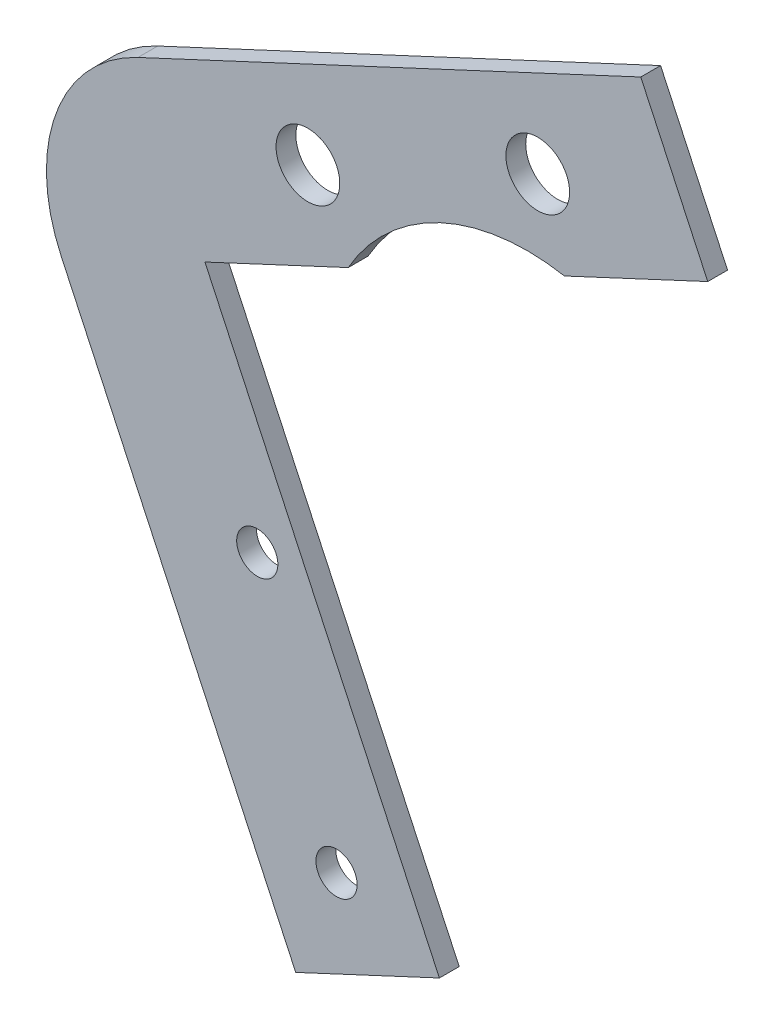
SolidWorks part; units mm, degrees
ref_plane "Front Plane" through (0, 0, 0) normal (0, 0, 1) x (1, 0, 0)
ref_plane "Top Plane" through (0, 0, 0) normal (0, 1, 0) x (1, 0, 0)
ref_plane "Right Plane" through (0, 0, 0) normal (1, 0, 0) x (0, 0, -1)
sketch "Sketch1" plane through (0, 0, 0) normal (0, 0, 1) x (1, 0, 0)
  line L0 (-12.5292, 34.9181) -> (6.2562, -5.3673)
  line L1 (17.7663, 0) -> (-1.0191, 40.2854)
  line L2 (-1.0191, 40.2854) -> (10.4612, 45.6387)
  line L3 (39.2663, 59.0708) -> (33.8991, 70.5809)
  line L4 (33.8991, 70.5809) -> (-6.3863, 51.7955)
  line L5 (6.2562, -5.3673) -> (17.7663, 0)
  line L6 (0, 0) -> (0, 38.1) construction
  line L7 (0, 38.1) -> (17.7663, 0) construction
  line L8 (17.7663, 0) -> (0, 0) construction
  line L9 (25.6481, 59.7269) -> (7.2319, 51.1393) construction
  line L10 (16.44, 55.4331) -> (19.1236, 49.6781) construction
  line L11 (19.1236, 49.6781) -> (24.8129, 37.4774) construction
  line L12 (16.44, 55.4331) -> (13.7564, 61.1882) construction
  line L13 (27.7861, 53.7174) -> (39.2663, 59.0708)
  line L14 (27.7861, 53.7174) -> (10.4612, 45.6387) construction
  circle A0 centre (3.175, 22.225) radius 1.651
  circle A1 centre (9.525, 3.175) radius 1.651
  circle A2 centre (25.6481, 59.7269) radius 2.5527
  circle A3 centre (7.2319, 51.1393) radius 2.5527
  arc A4 (27.7861, 53.7174) -> (10.4612, 45.6387) centre (24.8129, 37.4774) ccw
  arc A5 (-12.5292, 34.9181) -> (-6.3863, 51.7955) centre (-1.0191, 40.2854) cw
  point P25 (-17.8964, 46.4282)
  dimension "D2" = 3.302
  dimension "D4" = 5.1054
  dimension "D9" = 33.02
  dimension "D14" = 12.7
  dimension "D1" = 9.525
  dimension "D3" = 3.175
  dimension "D5" = 19.05
  dimension "D6" = 20.32
  dimension "D7" = 38.1
  dimension "D8" = 19.812
  dimension "D10" = 44.45
  dimension "D11" = 12.7
  dimension "D12" = 12.7
  dimension "D13" = 57.15
extrude "Extrude1" add sketch "Sketch1" along normal blind 1.5875
